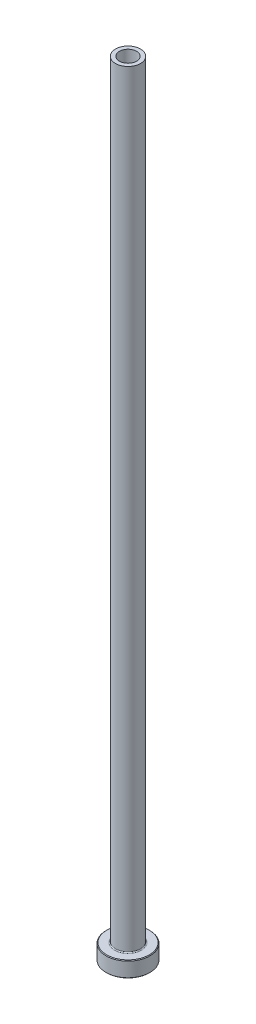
SolidWorks part; units mm, degrees
ref_plane "Front Plane" through (0, 0, 0) normal (0, 0, 1) x (1, 0, 0)
ref_plane "Top Plane" through (0, 0, 0) normal (0, 1, 0) x (1, 0, 0)
ref_plane "Right Plane" through (0, 0, 0) normal (1, 0, 0) x (0, 0, -1)
sketch "Sketch1" plane through (0, 0, 0) normal (0, 0, 1) x (1, 0, 0)
  line L0 (-2.75, 250) -> (-4, 250)
  line L1 (-4, 250) -> (-4, 5)
  line L2 (-4, 5) -> (-7, 5)
  line L3 (-7, 5) -> (-7, 0)
  line L4 (7.7, 0) -> (-7.7, 0) construction
  line L5 (-7, 0) -> (-3, 0)
  line L6 (-2.75, 205) -> (-2.75, 250)
  line L7 (0, 92.1877) -> (0, -15.5353) construction
  line L8 (0, -7.7) -> (0, 7.7) construction
  line L9 (-2.75, 205) -> (-3, 193)
  line L10 (-3, 193) -> (-3, 0)
  dimension "D1" = 0.25
  dimension "ID" = 5.5
  dimension "OD" = 8
  dimension "L" = 250
  dimension "H" = 14
  dimension "T" = 5
  dimension "N" = 45
  dimension "D2" = 12
revolve "Revolve1" add sketch "Sketch1" angle 360 about L7
fillet "Fillet1" radius 0.3 1 edges at (0, 5, 4)
chamfer "Chamfer1" distance 0.2 angle 45 2 edges at (0, 5, 7) (0, 0, 7)
chamfer "Chamfer3" distance 0.5 angle 45 1 edges at (0, 0, 3)
